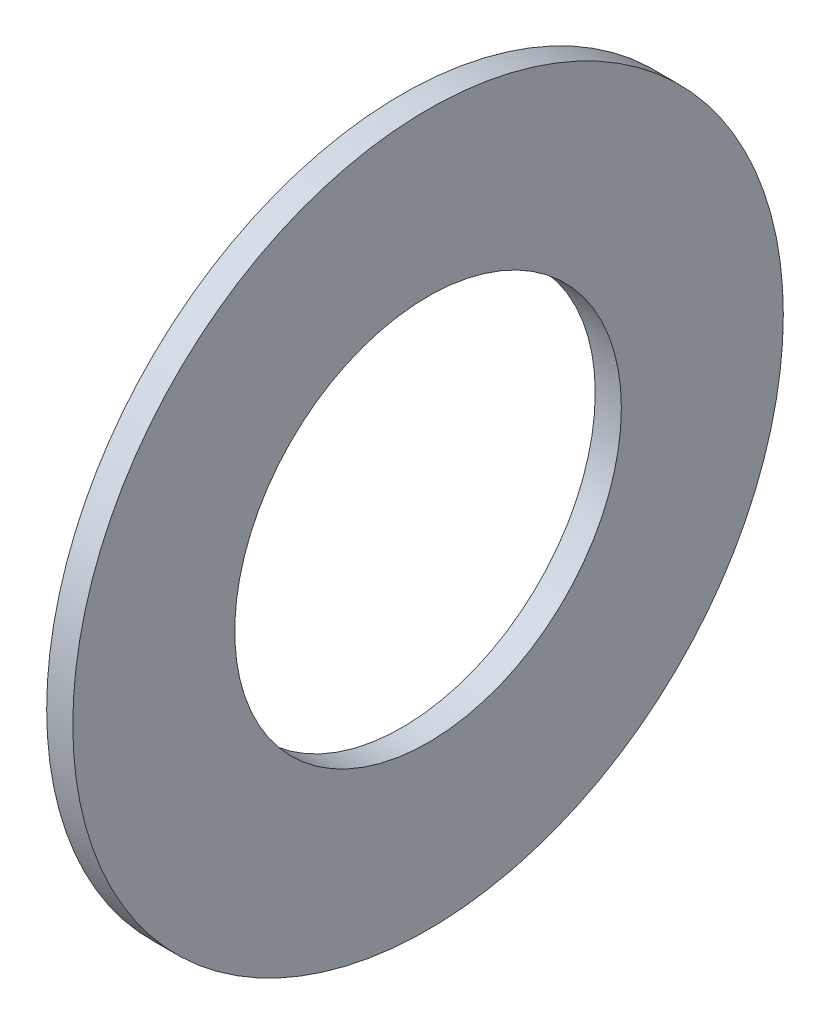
SolidWorks part; units mm, degrees
ref_plane "Plane1" through (0, 0, 0) normal (0, 0, 1) x (1, 0, 0)
ref_plane "Plane2" through (0, 0, 0) normal (0, 1, 0) x (1, 0, 0)
ref_plane "Plane3" through (0, 0, 0) normal (1, 0, 0) x (0, 0, -1)
other "Configuration Table"
sketch "Sketch1" plane through (0, 0, 0) normal (1, 0, 0) x (0, 0, -1)
  circle A0 centre (0, 0) radius 18.5
  circle A1 centre (0, 0) radius 34
  dimension "InsideDia" = 37
  dimension "OutsideDia" = 68
extrude "Base-Extrude" add sketch "Sketch1" along normal blind 2.5
